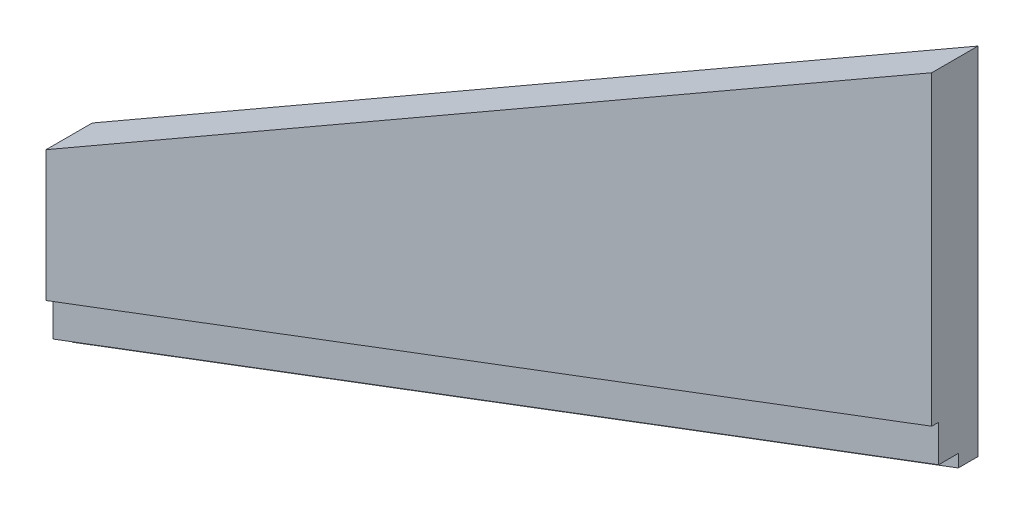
SolidWorks part; units mm, degrees
ref_plane "Спереди" through (0, 0, 0) normal (0, 0, 1) x (1, 0, 0)
ref_plane "Сверху" through (0, 0, 0) normal (0, 1, 0) x (1, 0, 0)
ref_plane "Справа" through (0, 0, 0) normal (1, 0, 0) x (0, 0, -1)
sketch "Эскиз1" plane through (0, 0, 0) normal (0, 0, 1) x (1, 0, 0)
  line L3 (-900, -1138.4871) -> (-900, -1271.2097)
  line L4 (0, -620.7803) -> (0, -931.8468)
  line L18 (0, -620.7803) -> (-900, -1138.4871)
  line L21 (0, -931.8468) -> (-900, -1271.2097)
extrude "Вытянуть1" add sketch "Эскиз1" along normal blind 47
sketch "Эскиз2" plane through (0, 0, 0) normal (0, 0, -1) x (-1, 0, 0)
  line L0 (0, -931.8468) -> (0, -969.2524)
  line L1 (900, -1271.2097) -> (900, -1308.6152)
  line L2 (900, -1308.6152) -> (0, -969.2524)
  line L3 (900, -1271.2097) -> (0, -931.8468) construction
  line L8 (0, -931.8468) -> (900, -1271.2097)
  line L9 (900, -1271.2097) -> (900, -1138.4871)
  line L10 (900, -1138.4871) -> (0, -620.7803)
  line L11 (0, -620.7803) -> (0, -931.8468)
  line L12 (0, -931.8468) -> (900, -1271.2097)
  dimension "D1" = 35
  dimension "D2" = 0
extrude "Вытянуть2" add sketch "Эскиз2" against normal blind 40
sketch "Эскиз3" plane through (0, 0, 0) normal (0, 0, -1) x (-1, 0, 0)
  line L0 (0, -969.2524) -> (0, -982.0771)
  line L1 (900, -1308.6152) -> (900, -1321.4399)
  line L2 (900, -1321.4399) -> (0, -982.0771)
  line L3 (0, -969.2524) -> (900, -1308.6152) construction
  line L8 (0, -620.7803) -> (0, -969.2524)
  line L9 (0, -969.2524) -> (900, -1308.6152)
  line L10 (900, -1308.6152) -> (900, -1138.4871)
  line L11 (900, -1138.4871) -> (0, -620.7803)
  line L13 (0, -969.2524) -> (900, -1308.6152)
  dimension "D1" = 12
  dimension "D2" = 0
extrude "Вытянуть3" add sketch "Эскиз3" against normal blind 20
